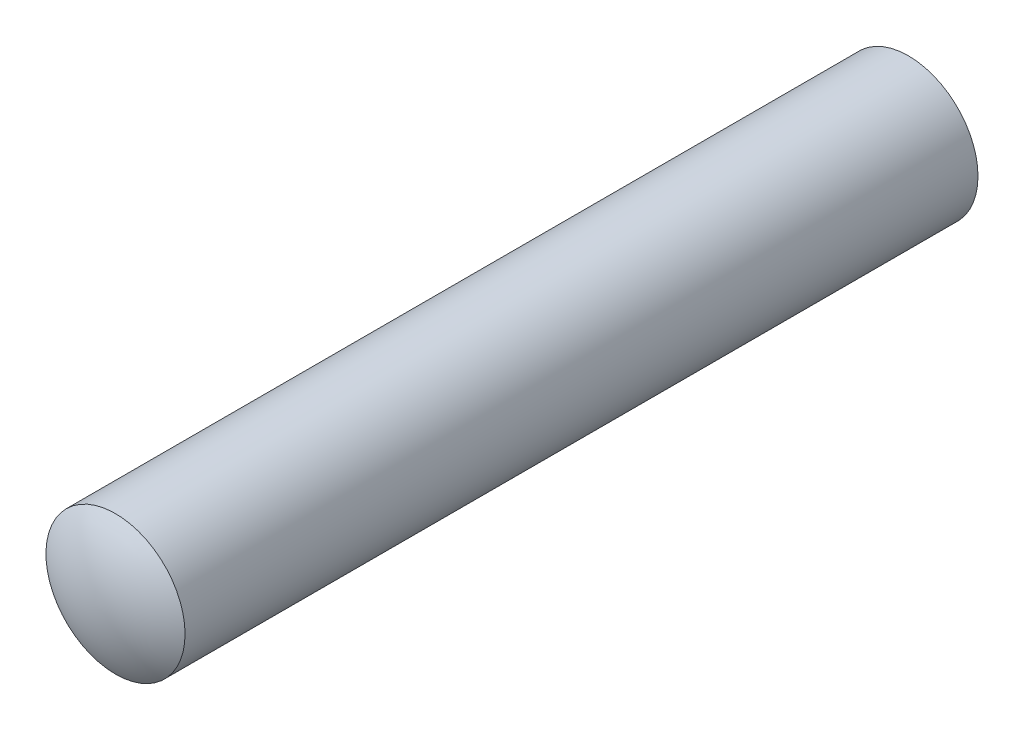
SolidWorks part; units mm, degrees
ref_plane "Plan1" through (0, 0, 0) normal (0, 0, 1) x (1, 0, 0)
ref_plane "Plan2" through (0, 0, 0) normal (0, 1, 0) x (1, 0, 0)
ref_plane "Plan3" through (0, 0, 0) normal (1, 0, 0) x (0, 0, -1)
sketch "E_corps" plane through (0, 0, 0) normal (1, 0, 0) x (0, 0, -1)
  line L0 (-10.7229, 0) -> (60.381, 0) construction
  line L1 (0, 0) -> (12, 0)
  line L2 (11.7, 1) -> (0.3, 1)
  arc A0 (0, 0) -> (0.3, 1) centre (1.8167, 0) cw
  arc A1 (12, 0) -> (11.7, 1) centre (10.1833, 0) ccw
revolve "Corps" add sketch "E_corps" angle 360 about L0
equation "\"D3@E_corps\" = \"C@E_corps\""
